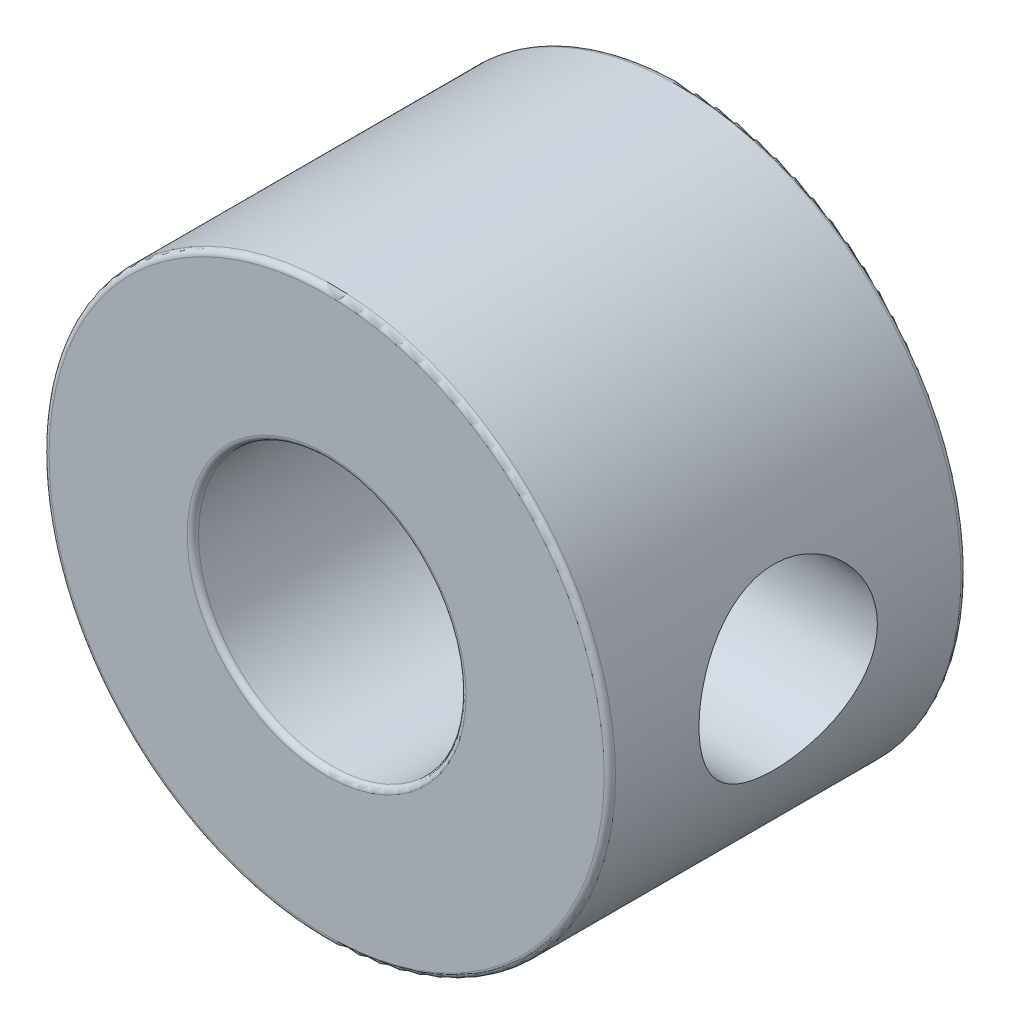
SolidWorks part; units mm, degrees
ref_plane "Front Plane" through (0, 0, 0) normal (0, 0, 1) x (1, 0, 0)
ref_plane "Top Plane" through (0, 0, 0) normal (0, 1, 0) x (1, 0, 0)
ref_plane "Right Plane" through (0, 0, 0) normal (1, 0, 0) x (0, 0, -1)
sketch "Sketch1" plane through (0, 0, 0) normal (0, 0, 1) x (1, 0, 0)
  circle A0 centre (0, 0) radius 6.35
  circle A1 centre (0, 0) radius 3
  point P4 (6.35, 0)
  dimension "Bore Dia" = 6
  dimension "OD" = 12.7
extrude "Extrude1" add sketch "Sketch1" along normal blind 8
ref_plane "Plane1" through (6.35, 0, 0) normal (1, 0, 0) x (0, 0, -1)
sketch "Sketch2" plane through (6.35, 0, 0) normal (1, 0, 0) x (0, 0, -1)
  line L0 (0, 0) -> (-8, 0) construction
  line L1 (-8, 6.35) -> (-8, -6.35) construction
  circle A0 centre (-4, 0) radius 2
  dimension "Set Screw Dia" = 4
extrude "Cut-Extrude1" cut sketch "Sketch2" against normal up to surface (6.35 mm away)
ref_plane "Plane2" through (0, 0, 4) normal (0, 0, 1) x (1, 0, 0)
fillet "Fillet1" radius 0.127 4 edges at (3, 0, 0) (3, 0, 8) (6.35, 0, 0) (6.35, 0, 8)
equation "\"D1@Fillet1\" = \"OD@Sketch1\"*.01"
